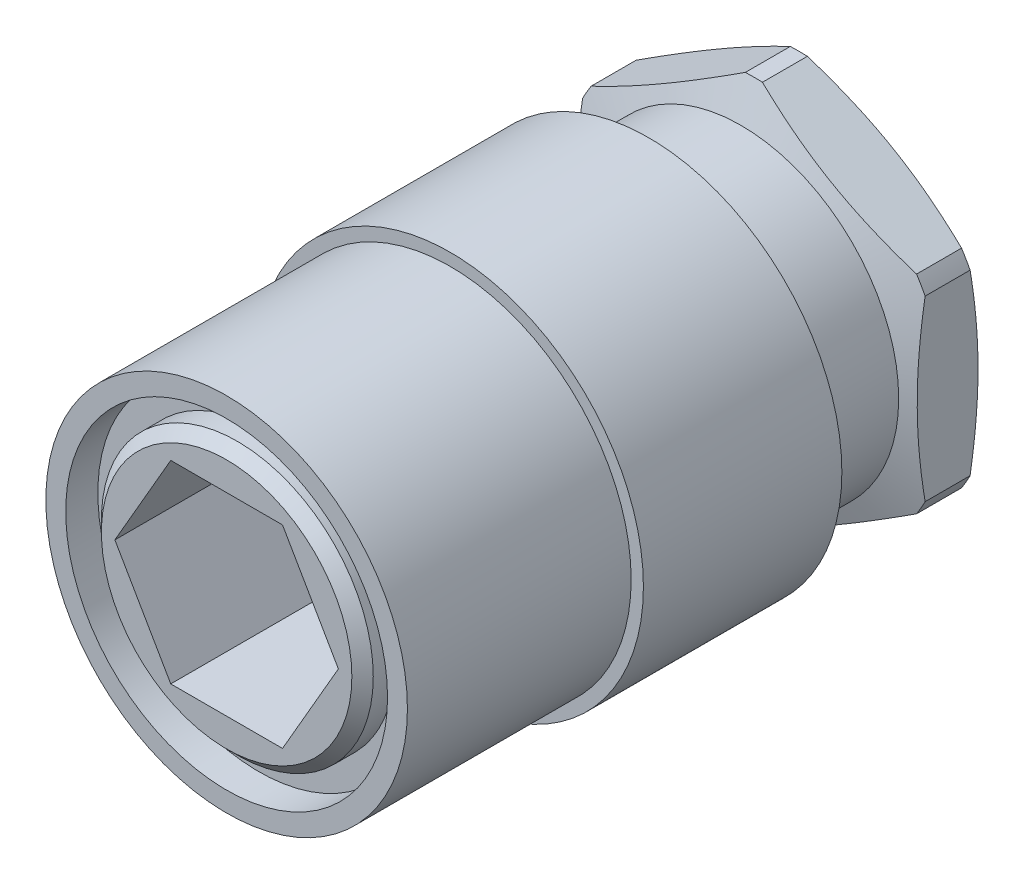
SolidWorks part; units mm, degrees
ref_plane "Front Plane" through (0, 0, 0) normal (0, 0, 1) x (1, 0, 0)
ref_plane "Top Plane" through (0, 0, 0) normal (0, 1, 0) x (1, 0, 0)
ref_plane "Right Plane" through (0, 0, 0) normal (1, 0, 0) x (0, 0, -1)
sketch "Sketch2" plane through (0, 0, 0) normal (0, 0, 1) x (1, 0, 0)
  circle A0 centre (0, 0) radius 9.017
  dimension "D1" = 18.034
extrude "Boss-Extrude1" add sketch "Sketch2" against normal blind 27.3304
sketch "Sketch5" plane through (0, 0, -27.3304) normal (0, 0, -1) x (-1, 0, 0)
  line L1 (-8.001, -4.6194) -> (0, -9.2388)
  line L2 (0, -9.2388) -> (8.001, -4.6194)
  line L3 (8.001, -4.6194) -> (8.001, 4.6194)
  line L4 (8.001, 4.6194) -> (0, 9.2388)
  line L5 (0, 9.2388) -> (-8.001, 4.6194)
  line L6 (-8.001, 4.6194) -> (-8.001, -4.6194)
  circle A0 centre (0, 0) radius 8.001 construction
  dimension "D1" = 16.002
extrude "Cut-Extrude1" cut sketch "Sketch5" against normal blind 3.302 flip side to cut
sketch "Sketch6" plane through (0, 0, 0) normal (1, 0, 0) x (0, 0, -1)
  line L0 (24.0284, 9.0081) -> (24.0284, 4.85) construction
  line L1 (24.0284, 7.366) -> (19.7231, 7.366)
  line L2 (24.0284, 7.366) -> (24.0284, 9.906)
  line L3 (24.0284, 9.906) -> (19.7231, 9.906)
  line L4 (19.7231, 7.366) -> (19.7231, 9.906)
  line L5 (0, 0) -> (27.3304, 0) construction
  line L6 (27.3304, -4.1582) -> (27.3304, 4.1582) construction
  dimension "D1" = 14.732
  dimension "D2" = 4.3053
  dimension "D3" = 2.54
revolve "Cut-Revolve1" cut sketch "Sketch6" angle 360 about L5
sketch "Sketch11" plane through (0, 0, 0) normal (0, 0, 1) x (1, 0, 0)
  circle A1 centre (0, 0) radius 6.35
  circle A2 centre (0, 0) radius 7.517
  circle A3 centre (0, 0) radius 7.517
  dimension "D2" = 12.7
  dimension "D1" = 1.5
extrude "Cut-Extrude3" cut sketch "Sketch11" against normal blind 1.5
sketch "Sketch12" plane through (0, 0, 0) normal (1, 0, 0) x (0, 0, -1)
  line L0 (24.0284, 9.5161) -> (24.0284, 7.366)
  line L1 (24.0284, 7.366) -> (24.811, 9.5161)
  line L2 (26.5478, 9.5161) -> (27.3304, 9.5161)
  line L3 (24.0284, 9.0081) -> (24.0284, 4.85) construction
  line L4 (0, 0) -> (27.3304, 0) construction
  line L5 (27.3304, -4.1582) -> (27.3304, 4.1582) construction
  line L7 (24.0284, 9.0081) -> (27.3304, 9.0081) construction
  line L11 (27.3304, 7.366) -> (27.3304, 9.5161)
  line L12 (27.3304, -8.001) -> (27.3304, 8.001) construction
  line L13 (24.0284, 9.5161) -> (24.811, 9.5161)
  line L17 (26.5478, 9.5161) -> (27.3304, 7.366)
  dimension "D1" = 7.366
  dimension "D2" = 20
  dimension "D3" = 20
  dimension "D4" = 0.508
revolve "Cut-Revolve2" cut sketch "Sketch12" angle 360 about L4
sketch "Sketch23" plane through (0, 0, -27.3304) normal (0, 0, -1) x (-1, 0, 0)
  circle A0 centre (0, 0) radius 6.858
  dimension "D1" = 13.716
extrude "Cut-Extrude7" cut sketch "Sketch23" against normal blind 10 draft 3
sketch "Sketch27" plane through (0, 0, 0) normal (1, 0, 0) x (0, 0, -1)
  line L0 (19.7231, -9.017) -> (19.7231, 9.017) construction
  line L1 (0, 9.017) -> (10.4521, 9.017)
  line L2 (0, 9.017) -> (0, 8.4455)
  line L3 (0, 8.4455) -> (10.4521, 8.4455)
  line L4 (10.4521, 9.017) -> (10.4521, 8.4455)
  line L5 (0, 0) -> (19.7231, 0) construction
  line L6 (19.7231, -7.366) -> (19.7231, 7.366) construction
  dimension "D1" = 9.271
  dimension "D2" = 16.891
revolve "Cut-Revolve5" cut sketch "Sketch27" angle 360 about L5
chamfer "Chamfer5" distance 1 angle 45 1 edges at (-6.858, 0, -27.3304)
chamfer "Chamfer7" distance 0.5 angle 45 1 edges at (6.35, 0, 0)
sketch "Sketch29" plane through (0, 0, 0) normal (1, 0, 0) x (0, 0, -1)
  line L0 (0, 0) -> (29.0322, 0)
  line L2 (29.0322, 0) -> (27.1991, 3.175)
  line L3 (10.4521, 4.445) -> (0, 4.445)
  line L4 (0, 8.4455) -> (0, -8.4455) construction
  line L5 (0, 4.445) -> (0, 0)
  line L6 (-3.9478, 0) -> (80.7658, 0) construction
  line L7 (10.4521, 4.445) -> (10.4521, 3.175)
  line L8 (10.4521, 3.175) -> (27.1991, 3.175)
  line L9 (10.4521, 9.017) -> (10.4521, -9.017) construction
  line L11 (27.1991, -49) -> (27.1991, 3.175) construction
  line L12 (27.1991, -7.7267) -> (27.1991, 7.7267) construction
  dimension "D1" = 8.89
  dimension "D2" = 60
  dimension "D3" = 6.35
revolve "Cut-Revolve6" cut sketch "Sketch29" angle 360 about L6
sketch "Sketch30" plane through (0, 0, 0) normal (0, 0, 1) x (1, 0, 0)
  line L1 (-2.6103, 4.5212) -> (-5.2206, 0)
  line L2 (-5.2206, 0) -> (-2.6103, -4.5212)
  line L3 (-2.6103, -4.5212) -> (2.6103, -4.5212)
  line L4 (2.6103, -4.5212) -> (5.2206, 0)
  line L5 (5.2206, 0) -> (2.6103, 4.5212)
  line L6 (2.6103, 4.5212) -> (-2.6103, 4.5212)
  circle A0 centre (0, 0) radius 4.5212 construction
  dimension "D1" = 9.0424
extrude "Cut-Extrude8" cut sketch "Sketch30" against normal up to surface (10.4521 mm away)
